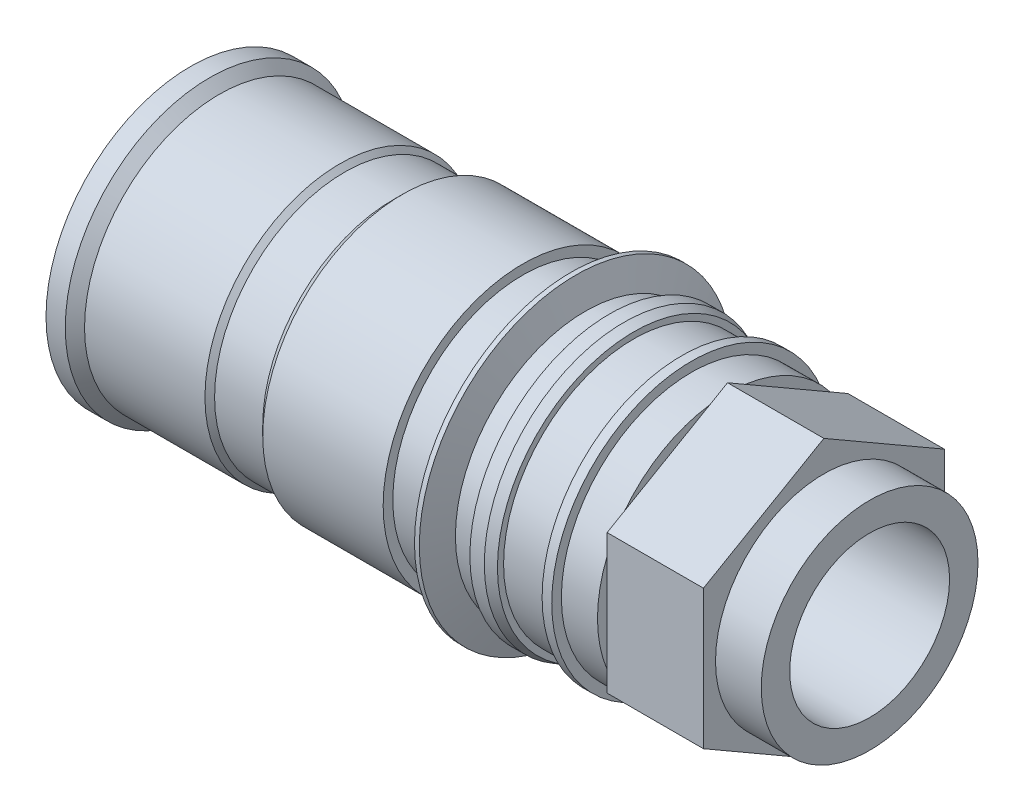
SolidWorks part; units mm, degrees
ref_plane "Alzado" through (0, 0, 0) normal (0, 0, 1) x (1, 0, 0)
ref_plane "Planta" through (0, 0, 0) normal (0, 1, 0) x (1, 0, 0)
ref_plane "Vista lateral" through (0, 0, 0) normal (1, 0, 0) x (0, 0, -1)
sketch "Croquis1" plane through (0, 0, 0) normal (0, 0, 1) x (1, 0, 0)
  line L0 (0, 0) -> (150.0259, 0) construction
  line L1 (0, 0) -> (0, 30)
  line L2 (0, 30) -> (4, 30)
  line L3 (4, 30) -> (6, 28)
  line L4 (6, 28) -> (31, 28)
  line L5 (31, 28) -> (32, 27)
  line L6 (32, 27) -> (42, 27)
  line L7 (42, 27) -> (44, 29)
  line L8 (44, 29) -> (69, 29)
  line L9 (69, 29) -> (69, 27)
  line L10 (69, 27) -> (77, 27)
  line L11 (77, 27) -> (79, 32.495)
  line L12 (79, 32.495) -> (80, 32.495)
  line L13 (80, 32.495) -> (82, 27)
  line L14 (82, 27) -> (87, 27)
  line L15 (87, 27) -> (87, 29)
  line L16 (87, 29) -> (90, 29)
  line L17 (90, 29) -> (92, 28.2721)
  line L18 (92, 28.2721) -> (92, 27)
  line L19 (92, 27) -> (102, 27)
  line L20 (102, 27) -> (102, 29)
  line L21 (102, 29) -> (104, 29)
  line L22 (104, 29) -> (104, 27)
  line L23 (104, 27) -> (111.5, 27)
  line L24 (111.5, 27) -> (111.5, 0)
  line L25 (111.5, 0) -> (0, 0)
  dimension "D1" = 111.5
  dimension "D2" = 60
  dimension "D3" = 4
  dimension "D4" = 135
  dimension "D5" = 2
  dimension "D6" = 25
  dimension "D7" = 1
  dimension "D8" = 10
  dimension "D9" = 2
  dimension "D10" = 25
  dimension "D11" = 2
  dimension "D12" = 8
  dimension "D13" = 2
  dimension "D14" = 110
  dimension "D15" = 1
  dimension "D16" = 2
  dimension "D17" = 5
  dimension "D18" = 2
  dimension "D19" = 3
  dimension "D20" = 10
  dimension "D21" = 2
  dimension "D22" = 2
revolve "Revolución1" add sketch "Croquis1" angle 360 about L0
sketch "Croquis2" plane through (111.5, 0, 0) normal (1, 0, 0) x (0, 0, -1)
  line L1 (0, 28.8675) -> (-25, 14.4338)
  line L2 (-25, 14.4338) -> (-25, -14.4338)
  line L3 (-25, -14.4338) -> (0, -28.8675)
  line L4 (0, -28.8675) -> (25, -14.4338)
  line L5 (25, -14.4338) -> (25, 14.4338)
  line L6 (25, 14.4338) -> (0, 28.8675)
  circle A0 centre (0, 0) radius 25 construction
  dimension "D1" = 50
extrude "Saliente-Extruir1" add sketch "Croquis2" along normal blind 20
sketch "Croquis3" plane through (131.5, 0, 0) normal (1, 0, 0) x (0, 0, -1)
  circle A0 centre (0, 0) radius 22.5
  dimension "D1" = 45
extrude "Saliente-Extruir2" add sketch "Croquis3" along normal blind 9.5
sketch "Croquis4" plane through (141, 0, 0) normal (1, 0, 0) x (0, 0, -1)
  circle A0 centre (0, 0) radius 16.6
  dimension "D1" = 33.2
extrude "Cortar-Extruir1" cut sketch "Croquis4" against normal through all
